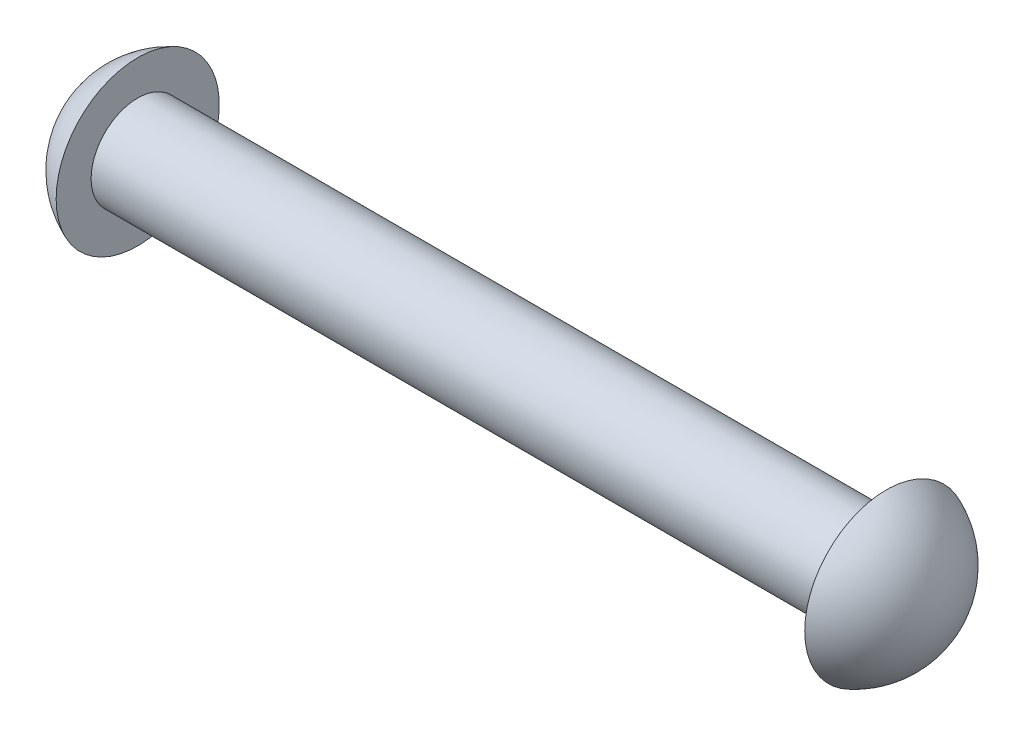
SolidWorks part; units mm, degrees
ref_plane "Plane1" through (0, 0, 0) normal (0, 0, 1) x (1, 0, 0)
ref_plane "Plane2" through (0, 0, 0) normal (0, 1, 0) x (1, 0, 0)
ref_plane "Plane3" through (0, 0, 0) normal (1, 0, 0) x (0, 0, -1)
sketch "Sketch1" plane through (0, 0, 0) normal (0, 0, 1) x (1, 0, 0)
  line L0 (-39, 0) -> (6, 0) construction
  line L1 (-17.26, 0) -> (0, 0)
  line L2 (-16.06, 1) -> (-16.06, 1.75)
  line L3 (-16.06, 1) -> (0, 1)
  line L4 (0, 1) -> (0, 0)
  arc A0 (-16.06, 1.75) -> (-17.26, 0) centre (-15.3601, -0.0164) ccw
  point P12 (-16.06, 1)
  dimension "HeadRadius" = 1.9
  dimension "Diameter" = 2
  dimension "GripLength" = 16.06
  dimension "HeadHt" = 1.2
  dimension "HeadDia" = 3.5
revolve "Base-Revolve" add sketch "Sketch1" angle 360 about L0
sketch "Sketch3" plane through (0, 0, 0) normal (0, 0, 1) x (1, 0, 0)
  line L0 (-49, 0) -> (71, 0) construction
  line L1 (0, 0) -> (1.2, 0)
  line L2 (0, 0) -> (0, 1.75)
  arc A0 (1.2, 0) -> (0, 1.75) centre (-0.6999, -0.0164) ccw
  dimension "D1" = 3.5
  dimension "D3" = 1.9
  dimension "D2" = 1.2
revolve "HeadTypeA" add sketch "Sketch3" angle 360 about L0
sketch "Sketch4" plane through (0, 0, 0) normal (0, 0, 1) x (1, 0, 0)
  line L0 (30, 0) -> (-54, 0) construction
  line L1 (-39, 0) -> (6, 0) construction
  line L2 (0, 0) -> (0, 1.75)
  line L3 (0, 1.75) -> (-0.9774, 1)
  line L4 (-0.9774, 0) -> (0, 0)
  line L5 (0, -1.75) -> (-0.9774, -1) construction
  line L6 (-0.9774, 0) -> (-0.9774, 1)
  dimension "D1" = 3.5
  dimension "D2" = 75
  dimension "D3" = 2
revolve "HeadTypeB" [suppressed] add sketch "Sketch4" angle 360 about L0
equation "\"D1@Sketch3\" = \"HeadDia@Sketch1\""
equation "\"D2@Sketch3\" = \"HeadHt@Sketch1\""
equation "\"D3@Sketch3\" = \"HeadRadius@Sketch1\""
equation "\"D1@Sketch4\" = \"HeadDia@Sketch1\""
equation "\"D3@Sketch4\" = \"Diameter@Sketch1\""
